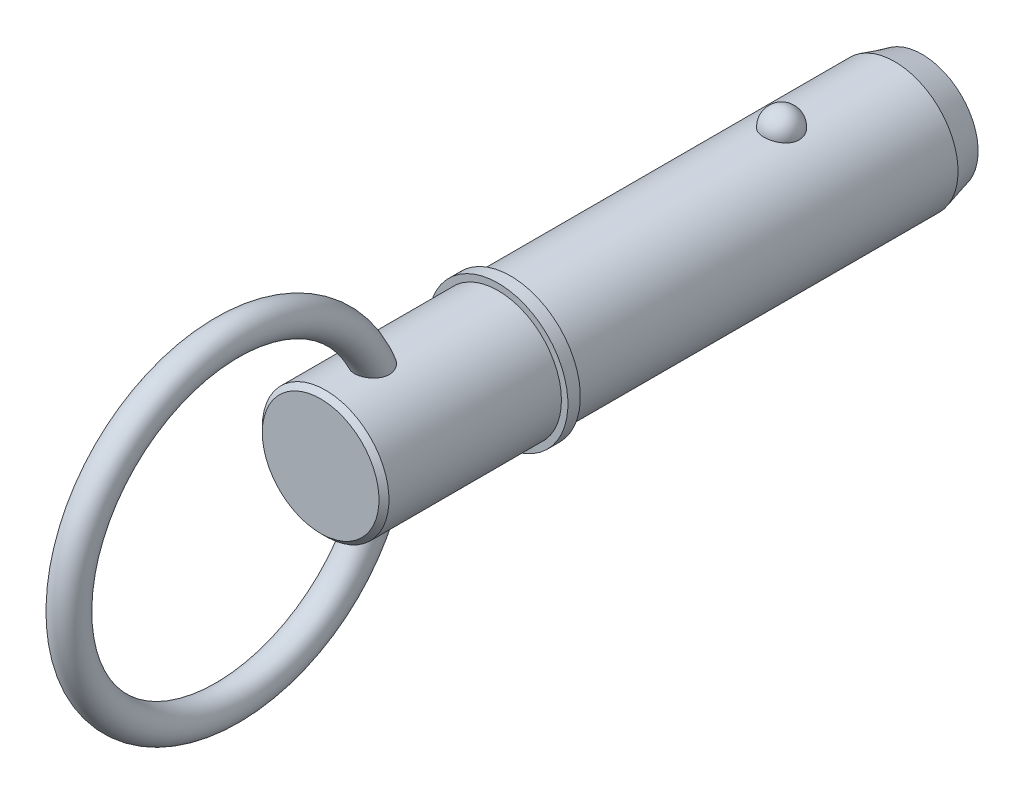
SolidWorks part; units mm, degrees
ref_plane "Front Plane" through (0, 0, 0) normal (0, 0, 1) x (1, 0, 0)
ref_plane "Top Plane" through (0, 0, 0) normal (0, 1, 0) x (1, 0, 0)
ref_plane "Right Plane" through (0, 0, 0) normal (1, 0, 0) x (0, 0, -1)
sketch "Sketch2" plane through (0, 0, 0) normal (0, 0, 1) x (1, 0, 0)
  circle A0 centre (0, 0) radius 12.7
  point P3 (0, 12.7)
  dimension "D1" = 25.4
extrude "Boss-Extrude1" add sketch "Sketch2" along normal blind 50.8
sketch "Sketch3" plane through (0, 0, 0) normal (0, 0, -1) x (-1, 0, 0)
  circle A0 centre (0, 0) radius 12.7
  dimension "D1" = 25.4
extrude "Boss-Extrude2" add sketch "Sketch3" along normal blind 31.75
chamfer "Chamfer1" distance 5.5 angle 15 1 edges at (-12.7, 0, -31.75)
sketch "Sketch18" plane through (0, 0, 0) normal (1, 0, 0) x (0, 0, -1)
  line L0 (26.25, 12.7) -> (-50.8, 12.7) construction
  line L1 (3.56, 16.26) -> (3.56, 9.14)
  line L2 (-50.8, -12.7) -> (26.25, -12.7) construction
  arc A0 (3.56, 16.26) -> (3.56, 9.14) centre (3.56, 12.7) ccw
  point P4 (0, 12.7)
  dimension "D1" = 28.96
revolve "Revolve1" add sketch "Sketch18" angle 360 about L1
sketch "Sketch19" plane through (0, 0, 0) normal (1, 0, 0) x (0, 0, -1)
  line L0 (-33.7288, 0) -> (-46.4542, 0) construction
sketch "Sketch20" plane through (0, 0, 0) normal (1, 0, 0) x (0, 0, -1)
  line L0 (-50.8, 0) -> (-50.8, 14)
  line L1 (-50.8, 12.7) -> (-50.8, -12.7) construction
  line L2 (-50.8, 14) -> (-53.3, 14)
  line L3 (-53.3, 14) -> (-53.3, 0)
  line L4 (-33.7288, 0) -> (-46.4542, 0) construction
  line L5 (-53.3, 0) -> (-50.8, 0)
  dimension "D1" = 14
  dimension "D2" = 2.5
revolve "Revolve2" add sketch "Sketch20" angle 360 about L0
sketch "Sketch21" plane through (0, 0, 50.8) normal (0, 0, -1) x (-1, 0, 0)
  circle A0 centre (0, 0) radius 12.7
  dimension "D1" = 25.4
extrude "Boss-Extrude3" add sketch "Sketch21" against normal blind 38.1
chamfer "Chamfer2" distance 1 angle 45 1 edges at (-12.7, 0, 88.9)
sketch "Sketch23" plane through (0, 0, 0) normal (1, 0, 0) x (0, 0, -1)
  line L0 (-88.9, 11.7) -> (-88.9, -11.7) construction
  circle A0 centre (-107.65, 0) radius 31.75
  point P2 (-75.9, 0)
  dimension "D1" = 63.5
  dimension "D2" = 13
sketch "Sketch24" plane through (0, 0, 0) normal (0, 1, 0) x (1, 0, 0)
  circle A0 centre (0, -75.9) radius 3.25
  dimension "D1" = 6.5
sweep "Sweep1" add profiles "Sketch24" path "Sketch23"
